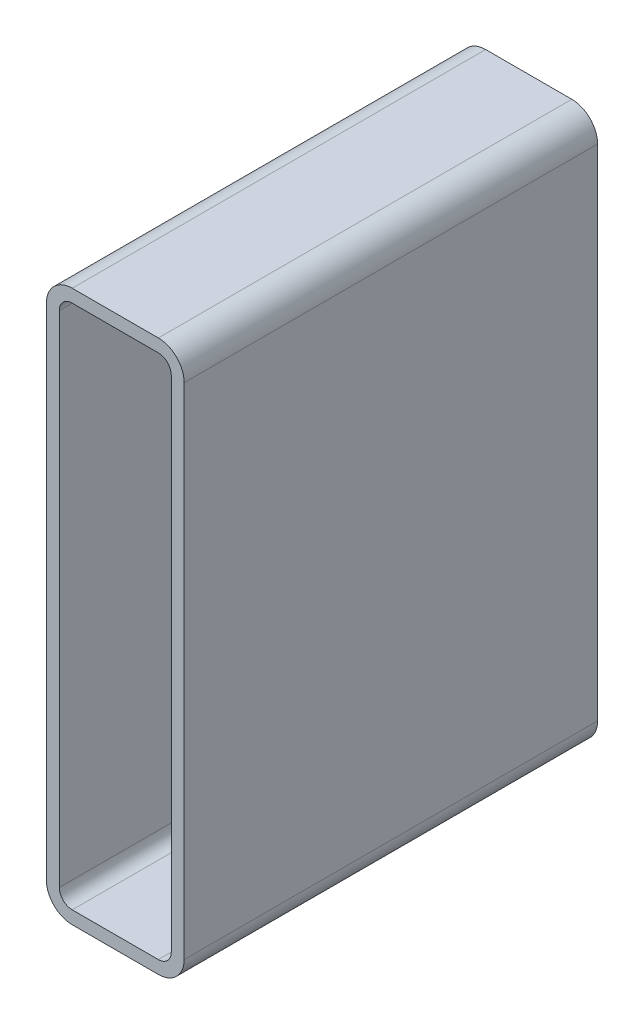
SolidWorks part; units mm, degrees
ref_plane "Front Plane" through (0, 0, 0) normal (0, 0, 1) x (1, 0, 0)
ref_plane "Top Plane" through (0, 0, 0) normal (0, 1, 0) x (1, 0, 0)
ref_plane "Right Plane" through (0, 0, 0) normal (1, 0, 0) x (0, 0, -1)
sketch "Sketch1" plane through (0, 0, 0) normal (0, 0, 1) x (1, 0, 0)
sketch_block_instance "HSS16x4x0.375-1"
sketch_block "HSS16x4x0.375"
extrude "Boss-Extrude1" add sketch "Sketch1" along normal blind 304.8
